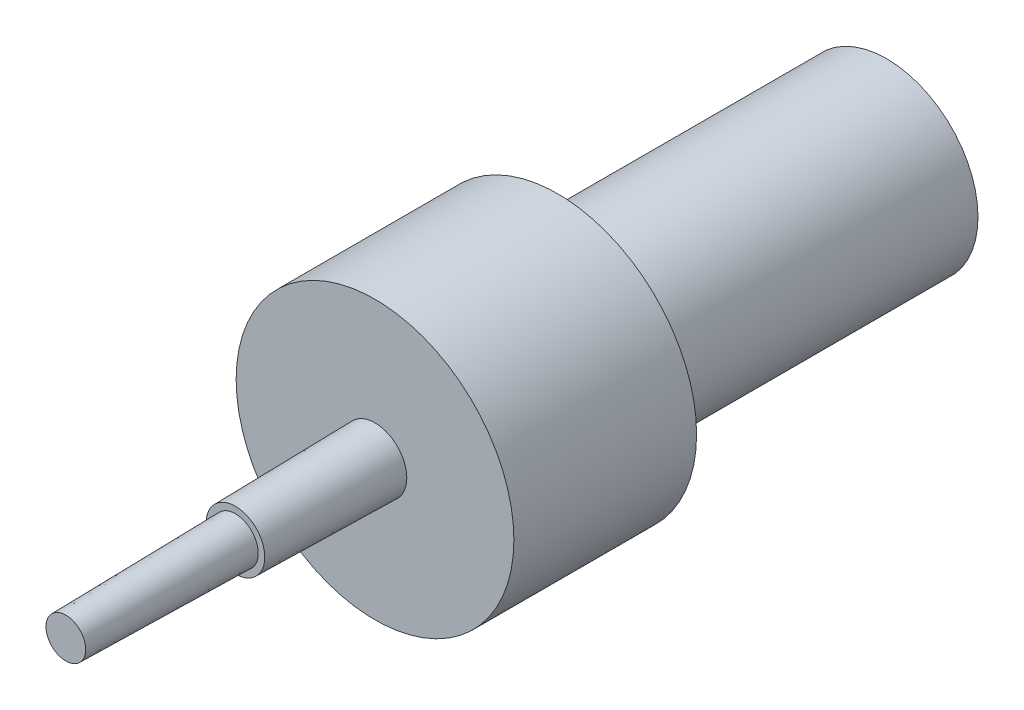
SolidWorks part; units mm, degrees
ref_plane "Front Plane" through (0, 0, 0) normal (0, 0, 1) x (1, 0, 0)
ref_plane "Top Plane" through (0, 0, 0) normal (0, 1, 0) x (1, 0, 0)
ref_plane "Right Plane" through (0, 0, 0) normal (1, 0, 0) x (0, 0, -1)
sketch "Sketch1" plane through (0, 0, 0) normal (0, 0, 1) x (1, 0, 0)
  circle A0 centre (0, 0) radius 3.8
extrude "Extrude1" add sketch "Sketch1" along normal blind 5
sketch "Sketch2" plane through (0, 0, 5) normal (0, 0, 1) x (1, 0, 0)
  circle A0 centre (0, 0) radius 0.87
extrude "Extrude2" add sketch "Sketch2" along normal blind 3.82 draft 1
sketch "Sketch3" plane through (0, 0, 8.82) normal (0, 0, 1) x (1, 0, 0)
  circle A0 centre (0, 0) radius 0.625
extrude "Extrude3" add sketch "Sketch3" along normal blind 4.64 draft 1
sketch "Sketch4" plane through (0, 0, 0) normal (0, 0, -1) x (-1, 0, 0)
  circle A0 centre (0, 0) radius 2.5
extrude "Extrude4" add sketch "Sketch4" along normal blind 9
